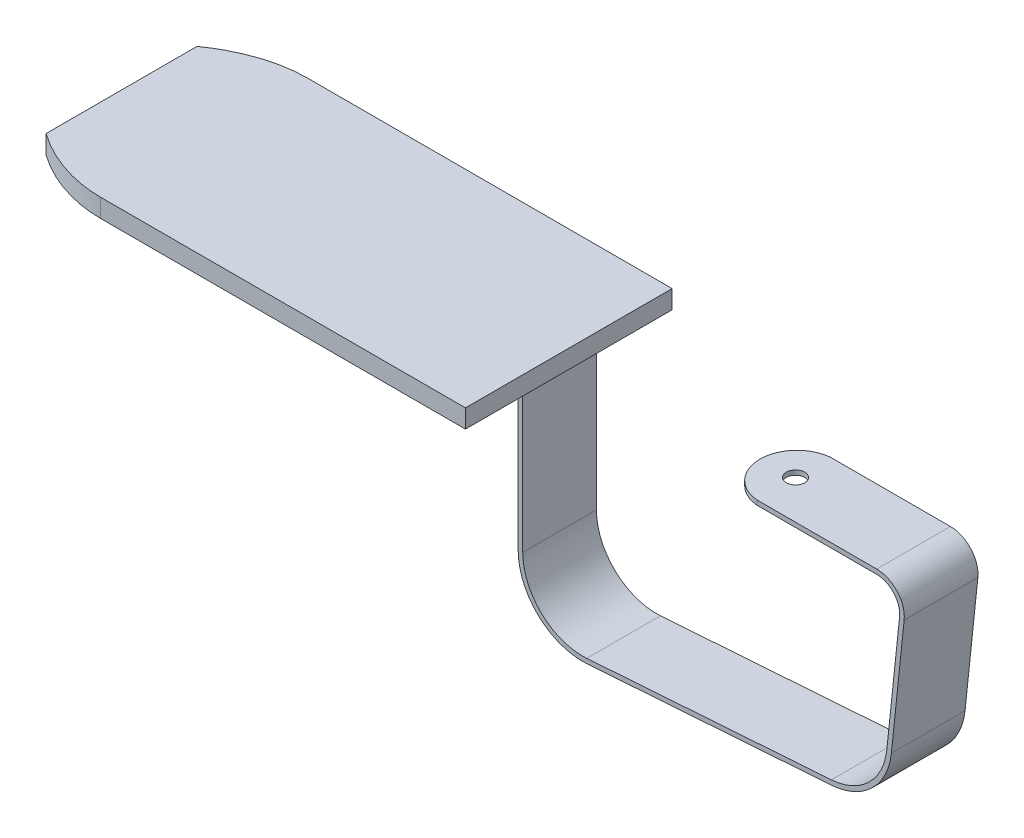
SolidWorks part; units mm, degrees
ref_plane "Front Plane" through (0, 0, 0) normal (0, 0, 1) x (1, 0, 0)
ref_plane "Top Plane" through (0, 0, 0) normal (0, 1, 0) x (1, 0, 0)
ref_plane "Right Plane" through (0, 0, 0) normal (1, 0, 0) x (0, 0, -1)
sketch "Sketch2" plane through (0, 0, 0) normal (0, 1, 0) x (1, 0, 0)
  line L0 (61.6585, 14.2431) -> (11.3531, 14.2431)
  line L1 (0, 10.4086) -> (0, -10.4086)
  line L2 (11.3531, -14.243) -> (61.6585, -14.243)
  line L3 (61.6585, -14.243) -> (61.6585, 14.2431)
  line L4 (60.3885, 12.973) -> (11.3531, 12.973)
  line L5 (1.27, 9.7337) -> (1.27, -9.7337)
  line L6 (11.3531, -12.9731) -> (60.3885, -12.9731)
  line L7 (60.3885, -12.9731) -> (60.3885, 12.973)
  spline S0 degree 3 poles (11.3531, 12.973) (10.4501, 12.973) (9.5592, 12.8923) (8.2385, 12.6676) (7.8009, 12.5753) (6.9308, 12.3574) (6.4968, 12.2312) (5.2176, 11.8091) (4.3922, 11.4698) (2.7921, 10.6841) (2.0172, 10.2381) (1.27, 9.7337) knots 0 0 0 0 0.25 0.25 0.375 0.375 0.5 0.5 0.75 0.75 1 1 1 1
  spline S1 degree 3 poles (1.27, -9.7337) (2.0176, -10.2384) (2.792, -10.684) (4.389, -11.4683) (5.2118, -11.8066) (6.9095, -12.3679) (7.7892, -12.5908) (9.5568, -12.8922) (10.4497, -12.9731) (11.3531, -12.9731) knots 0 0 0 0 0.25 0.25 0.5 0.5 0.75 0.75 1 1 1 1
  spline S2 degree 3 poles (11.3531, 14.2431) (10.3275, 14.2431) (8.2684, 14.0472) (5.3025, 13.2512) (2.9849, 12.2384) (1.4576, 11.3736) (0.5852, 10.8074) (0.1992, 10.5432) (0, 10.4086) knots 0 0 0 0 0.265597 0.531194 0.796792 0.92959 0.995989 1.062389 1.062389 1.062389 1.062389
  spline S3 degree 3 poles (0, -10.4086) (0.1994, -10.5432) (0.5856, -10.8077) (1.4581, -11.3739) (2.9848, -12.2381) (5.2907, -13.2467) (8.2608, -14.0463) (10.3251, -14.2431) (11.3531, -14.243) knots -0.062353 -0.062353 -0.062353 -0.062353 0.004044 0.070441 0.203236 0.468824 0.734412 1 1 1 1
  point P12 (0, 0)
extrude "Boss-Extrude1" add sketch "Sketch2" against normal blind 2.54
sketch "Sketch3" plane through (0, 0, 0) normal (0, 1, 0) x (1, 0, 0)
  line L0 (60.3885, 12.973) -> (11.3531, 12.973) construction
  line L1 (1.27, 9.7337) -> (1.27, -9.7337) construction
  line L2 (11.3531, -12.9731) -> (60.3885, -12.9731) construction
  line L3 (60.3885, -12.9731) -> (60.3885, 12.973) construction
  line L4 (60.3885, 12.973) -> (11.3531, 12.973)
  line L5 (1.27, 9.7337) -> (1.27, -9.7337)
  line L6 (11.3531, -12.9731) -> (60.3885, -12.9731)
  line L7 (60.3885, -12.9731) -> (60.3885, 12.973)
  spline S0 degree 3 poles (438.5282, -1939.5105) (122.3136, -143.6807) (52.5573, 20.207) (8.2385, 12.6676) (7.8009, 12.5753) (6.9308, 12.3574) (6.4968, 12.2312) (5.2176, 11.8091) (4.3922, 11.4698) (-45.361, -12.9587) (-0.006, -236.104) (708.3887, -1859.1038) knots -12.209256 -12.209256 -12.209256 -12.209256 0.25 0.25 0.375 0.375 0.5 0.5 0.75 0.75 16.046772 16.046772 16.046772 16.046772 only from (11.3531, 12.973) to (1.27, 9.7337) construction
  spline S1 degree 3 poles (678.0489, 1870.3844) (-5.3001, 228.4129) (-44.3267, 12.4564) (4.389, -11.4683) (5.2118, -11.8066) (6.9095, -12.3679) (7.7892, -12.5908) (53.4504, -20.3749) (121.5959, 151.1) (401.7015, 1947.1756) knots -14.752418 -14.752418 -14.752418 -14.752418 0.25 0.25 0.5 0.5 0.75 0.75 13.416321 13.416321 13.416321 13.416321 only from (1.27, -9.7337) to (11.3531, -12.9731) construction
  spline S2 degree 3 poles (11.3531, 12.973) (10.4501, 12.973) (9.5592, 12.8923) (8.2385, 12.6676) (7.8009, 12.5753) (6.9308, 12.3574) (6.4968, 12.2312) (5.2176, 11.8091) (4.3922, 11.4698) (2.7921, 10.6841) (2.0172, 10.2381) (1.27, 9.7337) knots 0 0 0 0 0.25 0.25 0.375 0.375 0.5 0.5 0.75 0.75 1 1 1 1
  spline S3 degree 3 poles (1.27, -9.7337) (2.0176, -10.2384) (2.792, -10.684) (4.389, -11.4683) (5.2118, -11.8066) (6.9095, -12.3679) (7.7892, -12.5908) (9.5568, -12.8922) (10.4497, -12.9731) (11.3531, -12.9731) knots 0 0 0 0 0.25 0.25 0.5 0.5 0.75 0.75 1 1 1 1
extrude "Boss-Extrude2" add sketch "Sketch3" against normal blind 1.27
sketch "Sketch4" plane through (0, 0, 0) normal (0, 0, 1) x (1, 0, 0)
  line L1 (59.7535, -2.54) -> (60.3885, -2.54)
  line L2 (69.2636, -31.339) -> (102.9883, -28.9807)
  line L3 (111.2095, -21.0416) -> (112.9724, -4.2683)
  line L4 (109.1833, -0.06) -> (88.0148, -0.06)
  line L5 (109.1833, -0.695) -> (88.0148, -0.695)
  line L6 (59.7535, -2.54) -> (59.7535, -22.4706)
  line L7 (110.578, -20.9753) -> (112.3409, -4.2019)
  line L8 (69.2193, -30.7055) -> (102.944, -28.3473)
  line L9 (60.3885, -3.175) -> (60.3885, -22.4706)
  line L10 (88.0148, -0.06) -> (88.0148, -0.695)
  line L11 (60.3885, -3.175) -> (60.3885, -2.54)
  line L12 (59.7535, -2.54) -> (61.0235, -2.54) construction
  line L13 (60.3885, -3.175) -> (61.0235, -3.175) construction
  arc A0 (102.9883, -28.9807) -> (111.2095, -21.0416) centre (102.3682, -20.1124) ccw
  arc A1 (69.2636, -31.339) -> (59.7535, -22.4706) centre (68.6435, -22.4706) cw
  arc A2 (112.9724, -4.2683) -> (109.1833, -0.06) centre (109.1833, -3.87) ccw
  arc A3 (112.3409, -4.2019) -> (109.1833, -0.695) centre (109.1833, -3.87) ccw
  arc A4 (102.944, -28.3473) -> (110.578, -20.9753) centre (102.3682, -20.1124) ccw
  arc A5 (69.2193, -30.7055) -> (60.3885, -22.4706) centre (68.6435, -22.4706) cw
  point P9 (110.4298, -28.4604)
  point P12 (59.7535, -32.004)
  point P14 (113.4148, -0.06)
  dimension "D6" = 8.89
  dimension "D8" = 3.81
  dimension "D1" = 86
  dimension "D2" = 29.464
  dimension "D3" = 50.8
  dimension "D4" = 100
  dimension "D7" = 25.4
  dimension "D9" = 0.635
extrude "Boss-Extrude4" add sketch "Sketch4" along normal mid plane 10.16 separate body
ref_plane "Plane1" through (0, -0.06, 0) normal (0, 1, 0) x (1, 0, 0)
sketch "Sketch5" plane through (0, -0.06, 0) normal (0, 1, 0) x (1, 0, 0)
  line L0 (92.6607, 5.08) -> (92.6607, 6.6435)
  line L2 (92.6607, 6.6435) -> (85.0536, 6.6435)
  line L3 (109.1833, 5.08) -> (88.0148, 5.08) construction
  line L4 (109.1833, -5.08) -> (88.0148, -5.08) construction
  line L5 (85.0536, 6.6435) -> (85.0536, -6.8489)
  line L6 (85.0536, -6.8489) -> (92.6607, -6.8489)
  line L7 (92.6607, -6.8489) -> (92.6607, -5.08)
  arc A0 (92.6607, 5.08) -> (92.6607, -5.08) centre (93.115, 0) ccw
  ellipse E2 centre (92.6607, 0.2591) end of major axis (91.3907, 0.2591) minor radius 1.27 (91.3907, 0.2591) -> (93.9307, 0.2591) cw
  ellipse E3 centre (92.6607, 0.2591) end of major axis (91.3907, 0.2591) minor radius 1.27 (93.9307, 0.2591) -> (91.3907, 0.2591) cw
extrude "Cut-Extrude1" cut sketch "Sketch5" against normal blind 10.16
